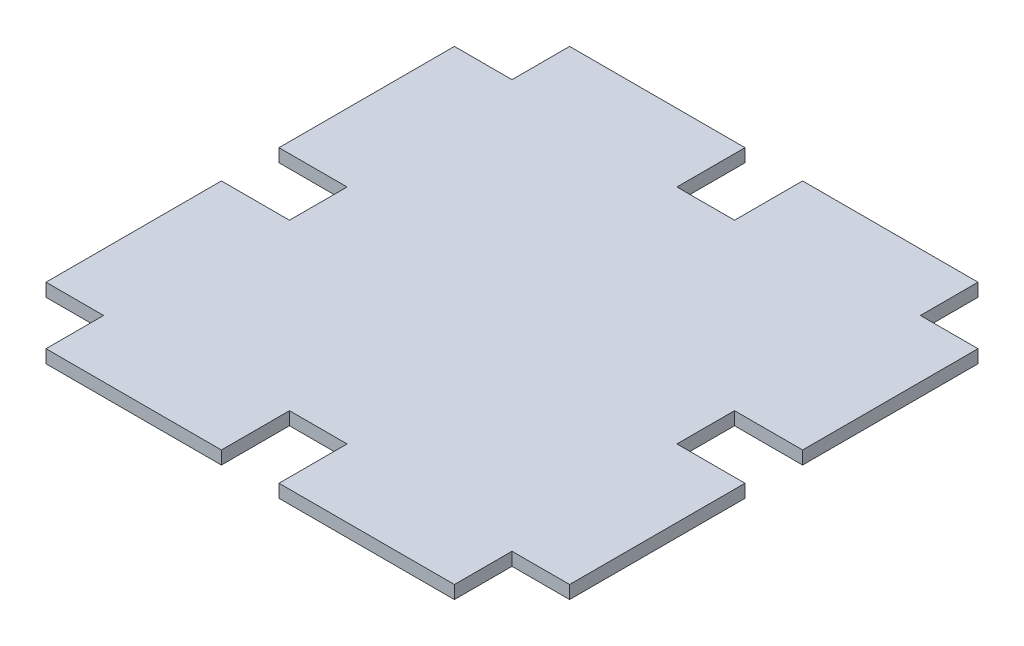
SolidWorks part; units mm, degrees
ref_plane "Front Plane" through (0, 0, 0) normal (0, 0, 1) x (1, 0, 0)
ref_plane "Top Plane" through (0, 0, 0) normal (0, 1, 0) x (1, 0, 0)
ref_plane "Right Plane" through (0, 0, 0) normal (1, 0, 0) x (0, 0, -1)
sketch "Sketch1" plane through (0, 0, 0) normal (0, 1, 0) x (1, 0, 0)
  line L0 (0, 127) -> (0, -127) construction
  line L1 (-127, 127) -> (127, 127)
  line L2 (-127, 127) -> (-127, -127)
  line L3 (-127, -127) -> (127, -127)
  line L4 (127, 127) -> (127, -127)
  line L5 (-127, 127) -> (127, -127) construction
  line L6 (-127, -127) -> (127, 127) construction
  line L7 (0, -127) -> (-127, 0) construction
  line L8 (-127, 0) -> (127, 0) construction
  line L9 (13.97, -127) -> (13.97, -93.98)
  line L10 (-13.97, 127) -> (13.97, 127)
  line L11 (-13.97, 127) -> (-13.97, 93.98)
  line L12 (-13.97, 93.98) -> (13.97, 93.98)
  line L13 (13.97, 127) -> (13.97, 93.98)
  line L14 (-13.97, 127) -> (13.97, 93.98) construction
  line L15 (-13.97, 93.98) -> (13.97, 127) construction
  line L16 (-127, 13.97) -> (-93.98, 13.97)
  line L17 (-127, 13.97) -> (-127, -13.97)
  line L18 (-127, -13.97) -> (-93.98, -13.97)
  line L19 (-93.98, 13.97) -> (-93.98, -13.97)
  line L20 (-127, 13.97) -> (-93.98, -13.97) construction
  line L21 (-127, -13.97) -> (-93.98, 13.97) construction
  line L22 (-13.97, -127) -> (-13.97, -93.98)
  line L23 (-13.97, -93.98) -> (13.97, -93.98)
  line L24 (127, -13.97) -> (93.98, -13.97)
  line L25 (93.98, 13.97) -> (93.98, -13.97)
  line L26 (127, 13.97) -> (93.98, 13.97)
  line L27 (-127, -99.06) -> (-99.06, -99.06)
  line L28 (-127, 127) -> (-99.06, 127)
  line L29 (-127, 127) -> (-127, 99.06)
  line L30 (-127, 99.06) -> (-99.06, 99.06)
  line L31 (-99.06, 127) -> (-99.06, 99.06)
  line L32 (127, 127) -> (99.06, 127)
  line L33 (127, 127) -> (127, 99.06)
  line L34 (127, 99.06) -> (99.06, 99.06)
  line L35 (99.06, 127) -> (99.06, 99.06)
  line L36 (-99.06, -127) -> (-99.06, -99.06)
  line L37 (127, -99.06) -> (99.06, -99.06)
  line L38 (99.06, -127) -> (99.06, -99.06)
  point P0 (0, 0)
  point P8 (0, 110.49)
  point P15 (-110.49, 0)
  dimension "D1" = 254
  dimension "D2" = 254
  dimension "D3" = 33.02
  dimension "D4" = 27.94
  dimension "D5" = 33.02
  dimension "D6" = 27.94
  dimension "D7" = 27.94
extrude "Boss-Extrude1" add sketch "Sketch1" along normal blind 6.35 contours L3 L38 L37 L4 L24 L25 L26 L34 L35 L1 L13 L12 L11 L31 L30 L2 L16 L19 L18 L27 L36 L22 L23 L9
